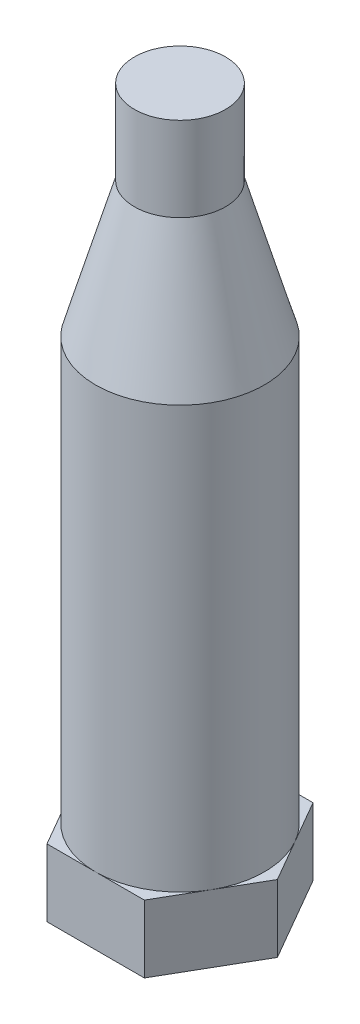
SolidWorks part; units mm, degrees
ref_plane "Front Plane" through (0, 0, 0) normal (0, 0, 1) x (1, 0, 0)
ref_plane "Top Plane" through (0, 0, 0) normal (0, 1, 0) x (1, 0, 0)
ref_plane "Right Plane" through (0, 0, 0) normal (1, 0, 0) x (0, 0, -1)
sketch "Sketch1" plane through (0, 0, 0) normal (0, 1, 0) x (1, 0, 0)
  line L0 (0, 0) -> (7.3323, 0)
  line L1 (7.3323, 0) -> (10.9985, 6.35)
  line L2 (10.9985, 6.35) -> (7.3323, 12.7)
  line L3 (7.3323, 12.7) -> (0, 12.7)
  line L4 (0, 12.7) -> (-3.6662, 6.35)
  line L5 (-3.6662, 6.35) -> (0, 0)
  dimension "D1" = 12.7
  dimension "D2" = 12.7
extrude "Extrude1" add sketch "Sketch1" along normal blind 5.08
sketch "Sketch2" plane through (0, 5.08, 0) normal (0, 1, 0) x (1, 0, 0)
  line L0 (9.1654, 9.525) -> (-1.8331, 3.175) construction
  line L1 (10.9985, 6.35) -> (7.3323, 12.7) construction
  line L2 (-3.6662, 6.35) -> (0, 0) construction
  circle A0 centre (3.6662, 6.35) radius 6.35
  dimension "D1" = 12.7
extrude "Extrude2" add sketch "Sketch2" along normal blind 31.75
ref_plane "Plane1" through (0, 0, -6.35) normal (0, 0, -1) x (-1, 0, 0)
sketch "Sketch3" plane through (0, 0, -6.35) normal (0, 0, -1) x (-1, 0, 0)
  line L0 (-3.6662, 0) -> (-3.6662, 54.0114) construction
  line L1 (-7.3323, 0) -> (0, 0) construction
  line L2 (-10.0162, 36.83) -> (-7.0952, 46.99)
  line L3 (-7.0952, 46.99) -> (-7.0952, 53.34)
  line L4 (-7.0952, 53.34) -> (-3.6662, 53.34)
  line L5 (-3.6662, 53.34) -> (-3.6662, 36.83)
  line L6 (2.6838, 36.83) -> (-10.0162, 36.83) construction
  line L7 (-3.6662, 36.83) -> (-10.0162, 36.83)
  dimension "D1" = 10.16
  dimension "D2" = 3.429
  dimension "D3" = 6.35
revolve "Revolve1" add sketch "Sketch3" angle 360 about L0
